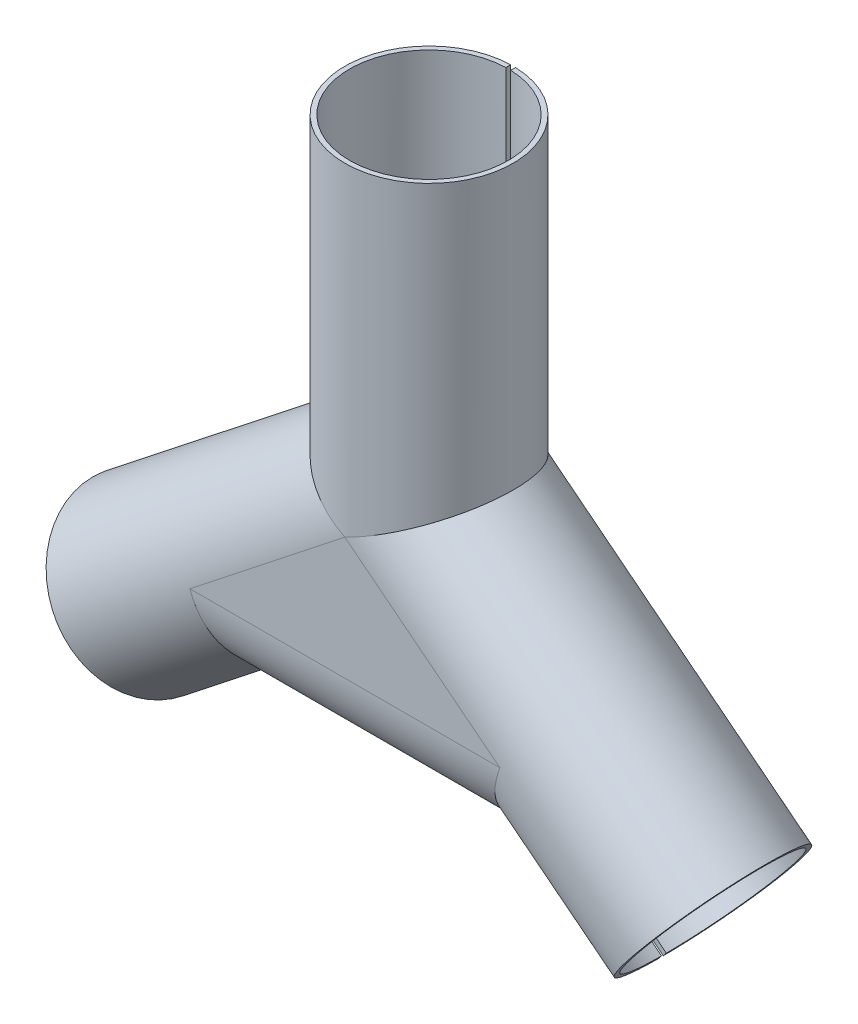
SolidWorks part; units mm, degrees
ref_plane "前视基准面" through (0, 0, 0) normal (0, 0, 1) x (1, 0, 0)
ref_plane "上视基准面" through (0, 0, 0) normal (0, 1, 0) x (1, 0, 0)
ref_plane "右视基准面" through (0, 0, 0) normal (1, 0, 0) x (0, 0, -1)
sketch "草图1" plane through (0, 0, 0) normal (0, 0, 1) x (1, 0, 0)
  line L0 (0, 67.2887) -> (0, 0) construction
  line L1 (0, 0) -> (-59.0019, -46.5051) construction
  line L2 (0, 0) -> (59.0019, -46.5051) construction
  line L3 (-17.4845, 67.2887) -> (17.4845, 67.2887) construction
  line L4 (69.8252, -32.7733) -> (48.1786, -60.2368) construction
  line L5 (48.1786, -60.2368) -> (26.138, -42.8645) construction
  line L6 (26.138, -42.8645) -> (-26.138, -42.8645) construction
  line L7 (-26.138, -42.8645) -> (-48.1786, -60.2368) construction
  line L8 (-48.1786, -60.2368) -> (-69.8252, -32.7733) construction
  line L9 (-69.8252, -32.7733) -> (-17.4845, 8.4815) construction
  line L10 (-17.4845, 8.4815) -> (-17.4845, 67.2887) construction
  line L11 (17.4845, 67.2887) -> (17.4845, 8.4815) construction
  line L12 (17.4845, 8.4815) -> (69.8252, -32.7733) construction
  line L13 (0, 0) -> (0, -42.8645) construction
  line L14 (-17.4845, 8.4815) -> (0, 0) construction
  line L15 (0, 0) -> (17.4845, 8.4815) construction
  line L16 (-26.138, -42.8645) -> (-32.2002, -25.3801) construction
  line L17 (26.138, -42.8645) -> (32.2002, -25.3801) construction
  line L18 (-32.2002, -25.3801) -> (32.2002, -25.3801) construction
  line L19 (26.138, -42.8645) -> (26.138, -25.3801) construction
  line L20 (0, 67.2887) -> (17.4845, 67.2887) construction
  line L21 (0, -42.8645) -> (0, -43.8645) construction
  line L22 (0, 0) -> (0, 67.2887)
  dimension "R" = 17.4845
  dimension "L1" = 67.2887
  dimension "L3" = 75.1262
  dimension "L2" = 41
  dimension "B" = 103.51
  dimension "t" = 1
sketch "草图2" plane through (0, 0, 0) normal (0, 1, 0) x (1, 0, 0)
  line L0 (0, 17.4845) -> (0, -17.4845) construction
  circle A0 centre (0, 0) radius 17.4845
extrude "拉伸-薄壁1" add sketch "草图2" along normal up to vertex (67.2887 mm away) thin
ref_plane "基准面1" through (59.0019, -46.5051, 0) normal (0.7854, -0.619, 0) x (0, 0, -1)
sketch "草图3" plane through (59.0019, -46.5051, 0) normal (0.7854, -0.619, 0) x (0, 0, -1)
  line L0 (0, 17.4845) -> (0, -17.4845) construction
  circle A0 centre (0, 0) radius 17.4845
extrude "拉伸-薄壁2" add sketch "草图3" against normal up to vertex (75.1262 mm away) separate body thin
ref_plane "基准面2" through (26.138, -25.3801, 0) normal (1, 0, 0) x (0, 0, -1)
sketch "草图4" plane through (26.138, -25.3801, 0) normal (1, 0, 0) x (0, 0, -1)
  circle A0 centre (0, 0) radius 17.4845
extrude "拉伸-薄壁3" add sketch "草图4" against normal up to vertex (58.3382 mm away) and the other way up to vertex (6.0622 mm away) separate body thin
ref_plane "基准面3" through (0, 0, 17.4845) normal (0, 0, 1) x (1, 0, 0)
sketch "草图6" plane through (0, 0, 0) normal (0, 0, 1) x (1, 0, 0)
  line L0 (0, 0) -> (17.4845, 8.4815) construction
  line L1 (-17.4845, 8.4815) -> (0, 0) construction
  line L2 (-17.4845, 8.4815) -> (-17.4845, 67.2887) construction
  line L3 (17.4845, 67.2887) -> (17.4845, 8.4815) construction
  line L4 (-17.4845, 67.2887) -> (17.4845, 67.2887) construction
  line L5 (0, 0) -> (17.4845, 8.4815)
  line L6 (-17.4845, 8.4815) -> (0, 0)
  line L7 (-17.4845, 8.4815) -> (-17.4845, 67.2887)
  line L8 (17.4845, 67.2887) -> (17.4845, 8.4815)
  line L9 (-17.4845, 67.2887) -> (17.4845, 67.2887)
extrude "切除-拉伸1" cut sketch "草图6" against normal through all and the other way through all flip side to cut
sketch "草图7" plane through (0, 0, 0) normal (0, 0, 1) x (1, 0, 0)
  line L0 (0, 0) -> (17.4845, 8.4815) construction
  line L1 (17.4845, 8.4815) -> (69.8252, -32.7733) construction
  line L2 (69.8252, -32.7733) -> (48.1786, -60.2368) construction
  line L3 (48.1786, -60.2368) -> (26.138, -42.8645) construction
  line L4 (26.138, -42.8645) -> (32.2002, -25.3801) construction
  line L5 (0, 0) -> (17.4845, 8.4815)
  line L6 (17.4845, 8.4815) -> (69.8252, -32.7733)
  line L7 (69.8252, -32.7733) -> (48.1786, -60.2368)
  line L8 (48.1786, -60.2368) -> (26.138, -42.8645)
  line L9 (26.138, -42.8645) -> (32.2002, -25.3801)
  line L10 (32.2002, -25.3801) -> (0, 0)
extrude "切除-拉伸2" cut sketch "草图7" against normal through all and the other way through all flip side to cut
sketch "草图8" plane through (0, 0, 0) normal (0, 0, 1) x (1, 0, 0)
  line L0 (26.138, -42.8645) -> (32.2002, -25.3801) construction
  line L1 (-32.2002, -25.3801) -> (32.2002, -25.3801) construction
  line L2 (26.138, -42.8645) -> (-26.138, -42.8645) construction
  line L3 (-26.138, -42.8645) -> (-32.2002, -25.3801) construction
  line L4 (26.138, -42.8645) -> (32.2002, -25.3801)
  line L5 (-32.2002, -25.3801) -> (32.2002, -25.3801)
  line L6 (26.138, -42.8645) -> (-26.138, -42.8645)
  line L7 (-26.138, -42.8645) -> (-32.2002, -25.3801)
extrude "切除-拉伸3" cut sketch "草图8" against normal through all and the other way through all flip side to cut
sketch "草图5" plane through (0, 0, 17.4845) normal (0, 0, 1) x (1, 0, 0)
  line L0 (0, 0) -> (-32.2002, -25.3801)
  line L1 (-32.2002, -25.3801) -> (32.2002, -25.3801)
  line L2 (32.2002, -25.3801) -> (0, 0)
extrude "凸台-拉伸1" add sketch "草图5" against normal blind 1
sketch "草图9" plane through (59.0019, -46.5051, 0) normal (0.7854, -0.619, 0) x (0, 0, -1)
  line L0 (0, 0) -> (0, -17.4845)
extrude "切除-拉伸-薄壁1" cut sketch "草图9" against normal through all thin
extrude "切除-拉伸-薄壁2" cut sketch "草图1" against normal through all thin
mirror "镜向1" about plane through (0, 0, 0) normal (0, 0, 1) of "凸台-拉伸1"
mirror "镜向2" about plane through (0, 0, 0) normal (1, 0, 0)
equation "\"D5@拉伸-薄壁1\" = \"t@草图1\""
equation "\"D5@拉伸-薄壁3\" = \"t@草图1\""
equation "\"D5@拉伸-薄壁2\" = \"t@草图1\""
equation "\"D1@凸台-拉伸1\" = \"t@草图1\""
